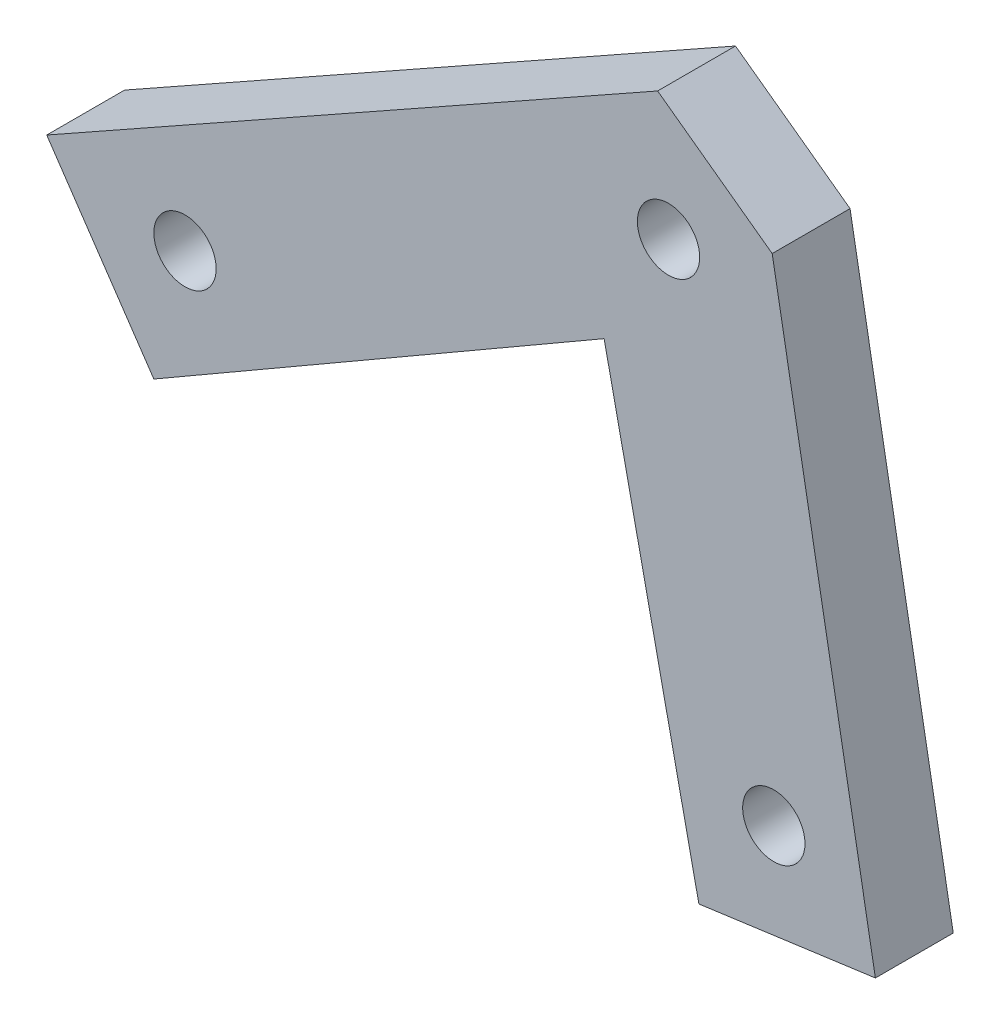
SolidWorks part; units mm, degrees
ref_plane "Front Plane" through (0, 0, 0) normal (0, 0, 1) x (1, 0, 0)
ref_plane "Top Plane" through (0, 0, 0) normal (0, 1, 0) x (1, 0, 0)
ref_plane "Right Plane" through (0, 0, 0) normal (1, 0, 0) x (0, 0, -1)
sketch "Sketch1" plane through (0, 0, 0) normal (0, 0, 1) x (1, 0, 0)
  line L0 (-37.7709, -4.4816) -> (-29.0365, -17.3464)
  line L1 (-29.0365, -17.3464) -> (7.6801, 3.864)
  line L2 (7.6801, 3.864) -> (15.4068, -32.1938)
  line L3 (15.4068, -32.1938) -> (29.7996, -30.2242)
  line L4 (29.7996, -30.2242) -> (21.3842, 16.7265)
  line L5 (21.3842, 16.7265) -> (12.043, 23.5374)
  line L6 (12.043, 23.5374) -> (-37.7709, -4.4816)
  circle A0 centre (-26.4965, -7.0216) radius 2.54
  circle A1 centre (12.9301, 13.5052) radius 2.54
  circle A2 centre (21.5172, -23.6145) radius 2.54
  point P0 (21.5172, -23.6145)
  point P1 (12.9301, 13.5052)
  point P2 (-26.4965, -7.0216)
  dimension "D4" = 5.08
  dimension "D5" = 5.08
  dimension "D6" = 5.08
  dimension "D1" = 50.8
  dimension "D2" = 38.1
  dimension "D3" = 44.45
extrude "Boss-Extrude1" add sketch "Sketch1" along normal blind 6.35
